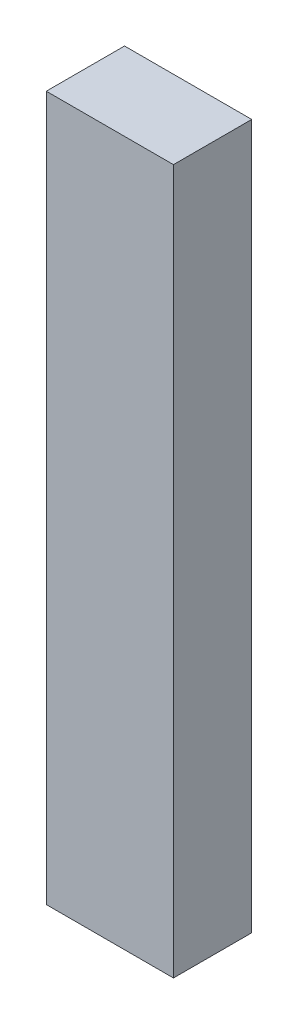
SolidWorks part; units mm, degrees
ref_plane "Front Plane" through (0, 0, 0) normal (0, 0, 1) x (1, 0, 0)
ref_plane "Top Plane" through (0, 0, 0) normal (0, 1, 0) x (1, 0, 0)
ref_plane "Right Plane" through (0, 0, 0) normal (1, 0, 0) x (0, 0, -1)
sketch "Sketch1" plane through (0, 0, 0) normal (0, 1, 0) x (1, 0, 0)
  line L1 (-41.275, 25.4) -> (41.275, 25.4)
  line L2 (-41.275, 25.4) -> (-41.275, -25.4)
  line L3 (-41.275, -25.4) -> (41.275, -25.4)
  line L4 (41.275, 25.4) -> (41.275, -25.4)
  line L5 (-41.275, 25.4) -> (41.275, -25.4) construction
  line L6 (-41.275, -25.4) -> (41.275, 25.4) construction
  point P0 (0, 0)
  dimension "D1" = 82.55
  dimension "D2" = 50.8
extrude "Boss-Extrude1" add sketch "Sketch1" along normal blind 457.2
sketch "Sketch2" [suppressed] plane through (0, 0, -19.05) normal (0, 0, -1) x (-1, 0, 0)
  line L0 (44.45, 457.2) -> (44.45, 247.65) construction
  line L1 (44.45, 457.2) -> (44.45, 0) construction
  line L3 (44.45, 247.65) -> (-44.45, 247.65)
  line L4 (44.45, 247.65) -> (44.45, 0)
  line L5 (44.45, 0) -> (-44.45, 0)
  line L6 (-44.45, 247.65) -> (-44.45, 0)
  dimension "D1" = 209.55
extrude "Cut-Extrude1" [suppressed] cut sketch "Sketch2" against normal through all
sketch "Sketch3" [suppressed] plane through (0, 0, 0) normal (0, -1, 0) x (-1, 0, 0)
  line L0 (44.45, -19.05) -> (37.7319, 19.05)
  line L1 (-44.45, 19.05) -> (44.45, 19.05) construction
  line L2 (37.7319, 19.05) -> (44.45, 19.05)
  line L3 (44.45, 19.05) -> (44.45, -19.05)
  dimension "D1" = 10
extrude "Cut-Extrude2" [suppressed] cut sketch "Sketch3" against normal through all
